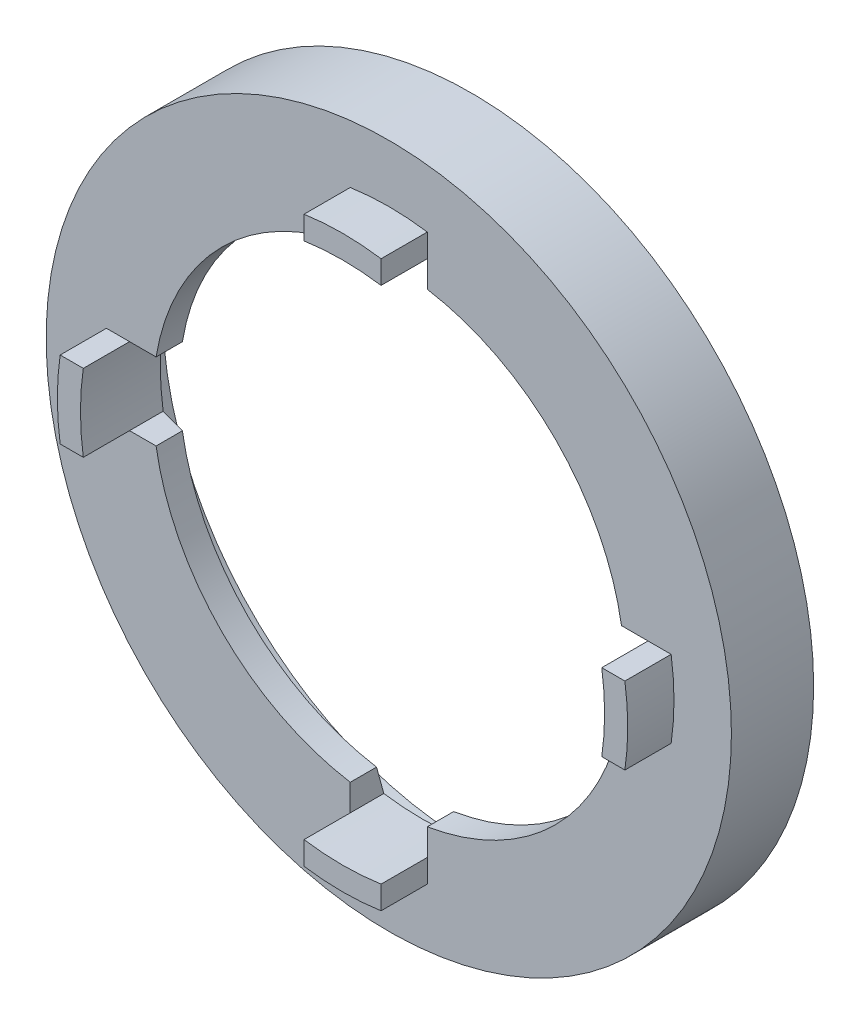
SolidWorks part; units mm, degrees
ref_plane "Front Plane" through (0, 0, 0) normal (0, 0, 1) x (1, 0, 0)
ref_plane "Top Plane" through (0, 0, 0) normal (0, 1, 0) x (1, 0, 0)
ref_plane "Right Plane" through (0, 0, 0) normal (1, 0, 0) x (0, 0, -1)
ref_plane "Plane1" through (0, 0, 1.8) normal (0, 0, 1) x (1, 0, 0)
ref_plane "Plane2" through (0, 0, 3.24) normal (0, 0, 1) x (1, 0, 0)
sketch "Sketch1" plane through (0, 0, 0) normal (0, 0, 1) x (1, 0, 0)
  circle A0 centre (0, 0) radius 22.225
  dimension "D1" = 44.45
extrude "Boss-Extrude1" add sketch "Sketch1" along normal blind 5.334
sketch "Sketch2" plane through (0, 0, 5.334) normal (0, 0, 1) x (1, 0, 0)
  circle A0 centre (0, 0) radius 15.3
  dimension "D1" = 30.6
extrude "Cut-Extrude1" cut sketch "Sketch2" against normal up to next
sketch "Sketch3" plane through (0, 0, 0) normal (0, 1, 0) x (1, 0, 0)
  line L0 (0, 1.4244) -> (0, 7.804) construction
  line L1 (0, -5.334) -> (0, 0) construction
  line L2 (-17, -3.1564) -> (-20, -3.1564)
  line L3 (0, -3.7116) -> (-15, -3.7116) construction
  line L4 (-22.225, -5.334) -> (22.225, -5.334) construction
  line L5 (-17, -3.1564) -> (-15, -3.7116)
  line L6 (-20, -3.1564) -> (-20, 0)
  line L7 (-20, 0) -> (-15, 0)
  line L8 (-15, 0) -> (-15, -3.7116)
  point P9 (-16, -3.434)
  dimension "D5" = 1.9
  dimension "D1" = 15
  dimension "D2" = 17
  dimension "D3" = 74.486
  dimension "D4" = 16
  dimension "D6" = 20
revolve "Cut-Revolve1" cut sketch "Sketch3" angle 360 about L0
sketch "Sketch4" plane through (0, 0, 5.334) normal (0, 0, 1) x (1, 0, 0)
  line L0 (0, 0) -> (-50000, 0) construction
  line L1 (-18.3152, 2.5) -> (-16.8152, 2.5)
  line L2 (-18.3152, -2.5) -> (-16.8152, -2.5)
  arc A0 (-16.8152, 2.5) -> (-16.8152, -2.5) centre (0, 0) ccw
  arc A1 (-18.3152, -2.5) -> (-18.3152, 2.5) centre (-1.5, 0) cw
  dimension "D1" = 17
  dimension "D3" = 1.5
  dimension "D2" = 5
  dimension "D4" = 1.5
extrude "Boss-Extrude2" add sketch "Sketch4" along normal blind 3
sketch "Sketch5" plane through (0, 0, 5.334) normal (0, 0, 1) x (1, 0, 0)
  line L0 (-16.8152, 2.5) -> (-15.0944, 2.5)
  line L1 (-16.8152, -2.5) -> (-15.0944, -2.5)
  line L2 (-15.0944, -2.5) -> (-15.0944, 2.5)
  arc A0 (-16.8152, 2.5) -> (-16.8152, -2.5) centre (0, 0) ccw
  circle A1 centre (0, 0) radius 15.3 construction
  arc A3 (-16.8152, 2.5) -> (-16.8152, -2.5) centre (0, 0) ccw construction
extrude "Cut-Extrude2" cut sketch "Sketch5" against normal through all
pattern_circular "CirPattern1" count 4 every 90 about axis through (0, 0, 0) along (0, 0, 1) of "Boss-Extrude2", "Cut-Extrude2"
